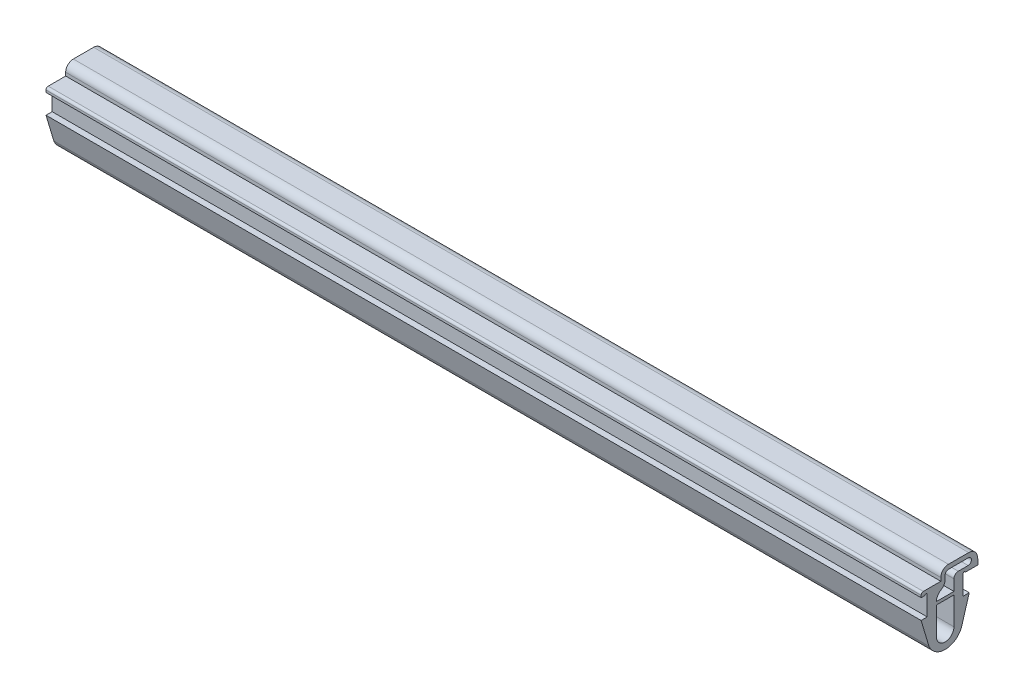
SolidWorks part; units mm, degrees
ref_plane "Front Plane" through (0, 0, 0) normal (0, 0, 1) x (1, 0, 0)
ref_plane "Top Plane" through (0, 0, 0) normal (0, 1, 0) x (1, 0, 0)
ref_plane "Right Plane" through (0, 0, 0) normal (1, 0, 0) x (0, 0, -1)
sketch3d "3DSketch1"
  line L0 (0, 0, 0) -> (200, 0, 0)
other "Tiivisteprofiilit 1.6027 TIIVISTEPROFIILI(1)"
ref_plane "Plane1" through (0, 0, 0) normal (1, 0, 0) x (0, 0, -1)
sketch "Sketch1" plane through (0, 0, 0) normal (1, 0, 0) x (0, 0, -1)
  line L0 (0.7378, 4.5533) -> (0.7378, 2.0533)
  line L1 (3.9878, 5.5533) -> (1.7378, 5.5533)
  line L2 (-0.5122, 7.0533) -> (3.9878, 7.0533)
  line L3 (-1.2622, 5.5174) -> (-1.2622, 6.3033)
  line L4 (-3.2622, -4.9467) -> (-3.2622, 1.3619)
  line L5 (-6.7622, 5.0533) -> (-6.7622, 4.5533)
  line L6 (-6.7622, 4.5533) -> (-5.8622, 4.5533)
  line L7 (-5.3622, 4.5533) -> (-5.3622, 0.0533)
  line L8 (-5.3622, 0.0533) -> (-6.7622, 0.0533)
  line L9 (-6.7622, 0.0533) -> (-4.9784, -5.9264)
  line L10 (2.454, -5.9264) -> (4.2378, 0.0533)
  line L11 (4.2378, 0.0533) -> (2.8378, 0.0533)
  line L12 (2.8378, 0.0533) -> (2.8378, 4.5533)
  line L13 (3.3378, 4.5533) -> (6.2378, 4.5533)
  line L14 (6.2378, 4.5533) -> (6.2378, 5.5533)
  line L15 (6.2378, 5.5533) -> (6.0884, 6.4006)
  line L16 (4.1188, 8.0533) -> (-0.5122, 8.0533)
  line L17 (-2.2622, 6.3033) -> (-2.2622, 5.5533)
  line L18 (-2.2622, 5.5533) -> (-6.2622, 5.5533)
  line L19 (-3.2622, 2.0533) -> (0.7378, 2.0533)
  line L20 (-3.2622, 1.3619) -> (0.7378, 1.3619)
  line L21 (0.7378, 1.3619) -> (0.7378, -4.9467)
  arc A0 (-6.2622, 5.5533) -> (-6.7622, 5.0533) centre (-6.2622, 5.0533) ccw
  arc A1 (-5.3622, 4.5533) -> (-5.8622, 4.5533) centre (-5.6122, 4.5533) ccw
  arc A2 (-4.9784, -5.9264) -> (2.454, -5.9264) centre (-1.2622, -4.4467) ccw
  arc A3 (3.3378, 4.5533) -> (2.8378, 4.5533) centre (3.0878, 4.5533) ccw
  arc A4 (6.0884, 6.4006) -> (4.1188, 8.0533) centre (4.1188, 6.0533) ccw
  arc A5 (-0.5122, 8.0533) -> (-2.2622, 6.3033) centre (-0.5122, 6.3033) ccw
  arc A6 (-3.2622, -4.9467) -> (0.7378, -4.9467) centre (-1.2622, -4.9467) ccw
  arc A7 (1.7378, 5.5533) -> (0.7378, 4.5533) centre (1.7378, 4.5533) ccw
  arc A8 (3.9878, 5.5533) -> (3.9878, 7.0533) centre (3.9878, 6.3033) ccw
  arc A9 (-0.5122, 7.0533) -> (-1.2622, 6.3033) centre (-0.5122, 6.3033) ccw
  arc A10 (-2.2622, 3.7854) -> (-1.2622, 5.5174) centre (-3.2622, 5.5174) ccw
  arc A11 (-2.2622, 3.7854) -> (-3.2622, 2.0533) centre (-1.2622, 2.0533) ccw
  point P45 (0, 0)
